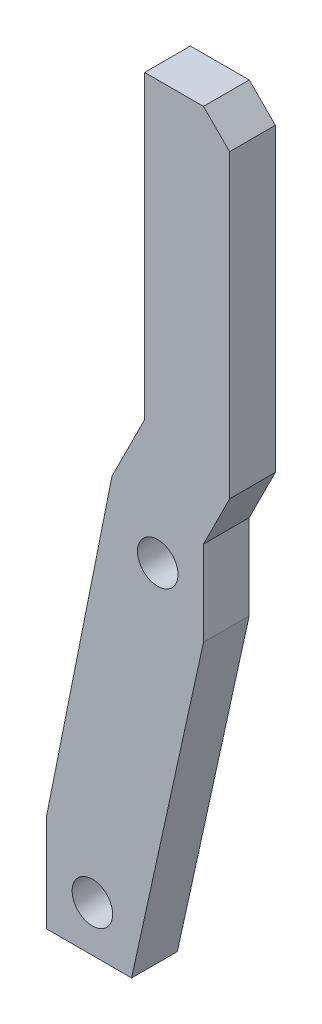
SolidWorks part; units mm, degrees
ref_plane "前视基准面" through (0, 0, 0) normal (0, 0, 1) x (1, 0, 0)
ref_plane "上视基准面" through (0, 0, 0) normal (0, 1, 0) x (1, 0, 0)
ref_plane "右视基准面" through (0, 0, 0) normal (1, 0, 0) x (0, 0, -1)
other "Configuration Table"
sketch "草图1" plane through (0, 0, 0) normal (0, 0, 1) x (1, 0, 0)
  line L0 (-7, -7) -> (6, -7)
  line L1 (6, -7) -> (17, 43)
  line L2 (17, 43) -> (17, 56)
  line L3 (17, 56) -> (21, 64)
  line L4 (21, 64) -> (21, 110)
  line L5 (21, 110) -> (17, 114)
  line L6 (17, 114) -> (8, 114)
  line L7 (8, 114) -> (8, 68)
  line L8 (8, 68) -> (3, 58)
  line L9 (3, 58) -> (-7, 8)
  line L10 (-7, 8) -> (-7, -7)
  dimension "D1" = 3
  dimension "D2" = 6
  dimension "D3" = 8
  dimension "D4" = 17
  dimension "D5" = 21
  dimension "D6" = 7
  dimension "D7" = 8
  dimension "D8" = 43
  dimension "D9" = 68
  dimension "D10" = 58
  dimension "D11" = 110
  dimension "D12" = 7
extrude "Parallel_Finger" add sketch "草图1" against normal mid plane 7
sketch "草图2" plane through (0, 0, 0) normal (0, 0, 1) x (1, 0, 0)
  circle A0 centre (0, 0) radius 3.1
  circle A1 centre (10, 50) radius 3.1
  dimension "D1" = 6.2
  dimension "D2" = 10
  dimension "D3" = 50
extrude "Finger_Pivots_10x50" cut sketch "草图2" against normal mid plane 500
